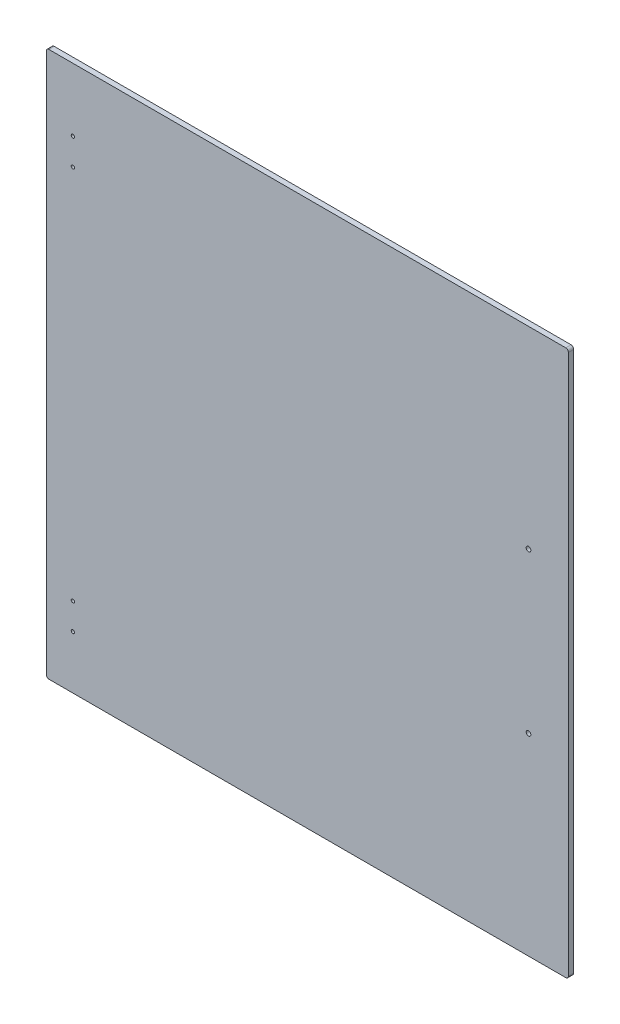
SolidWorks part; units mm, degrees
ref_plane "Ebene vorne" through (0, 0, 0) normal (0, 0, 1) x (1, 0, 0)
ref_plane "Ebene oben" through (0, 0, 0) normal (0, 1, 0) x (1, 0, 0)
ref_plane "Ebene rechts" through (0, 0, 0) normal (1, 0, 0) x (0, 0, -1)
sketch "Skizze1" plane through (0, 0, 0) normal (0, 0, 1) x (1, 0, 0)
  line L1 (-196.25, -205) -> (196.25, -205)
  line L2 (-196.25, -205) -> (-196.25, 205)
  line L3 (-196.25, 205) -> (196.25, 205)
  line L4 (196.25, -205) -> (196.25, 205)
  line L5 (-196.25, -205) -> (196.25, 205) construction
  line L6 (-196.25, 205) -> (196.25, -205) construction
  point P0 (0, 0)
  dimension "D1" = 410
  dimension "D2" = 392.5
extrude "Aufsatz-Linear austragen1" add sketch "Skizze1" along normal blind 4
fillet "Verrundung1" radius 2 4 edges at (-196.25, -205, 2) (196.25, -205, 2) (-196.25, 205, 2) (196.25, 205, 2)
hole_wizard "M3 Gewindebohrung1" positions "Skizze2" profile "Skizze3" tap size "M3" standard "DIN"
sketch "Skizze2" plane through (0, 0, 4) normal (0, 0, 1) x (1, 0, 0)
  line L0 (-196.25, 203) -> (-196.25, -203) construction
  line L1 (194.25, 205) -> (-194.25, 205) construction
  line L2 (-194.25, -205) -> (194.25, -205) construction
  point P0 (-176.25, 157.5)
  point P2 (-176.25, 137.5)
  point P4 (-176.25, -145)
  point P6 (-176.25, -165)
  dimension "D1" = 20
  dimension "D2" = 20
  dimension "D3" = 47.5
  dimension "D4" = 40
  dimension "D5" = 20
sketch "Skizze3" plane through (-176.25, 157.5, 4) normal (1, 0, 0) x (0, -1, 0)
  line L0 (0, 0) -> (0, 4)
  line L1 (0, 4) -> (1.25, 4)
  line L2 (1.25, 4) -> (1.25, 0)
  line L5 (1.25, 0) -> (0, 0)
  line L11 (0, -6.35) -> (0, 107.95) construction
  dimension "Bohrerdurchmesser" = 2.5
  dimension "Bohrungstiefe" = 4
hole_wizard "Ø3.5 (3.5) Durchmesser Bohrung1" positions "Skizze4" profile "Skizze5" hole size "Ø3.5" standard "DIN"
sketch "Skizze4" plane through (0, 0, 4) normal (0, 0, 1) x (1, 0, 0)
  line L0 (196.25, -203) -> (196.25, 203) construction
  point P0 (166.25, 60)
  point P2 (166.25, -60)
  dimension "D1" = 30
  dimension "D2" = 60
  dimension "D3" = 60
sketch "Skizze5" plane through (166.25, 60, 4) normal (1, 0, 0) x (0, -1, 0)
  line L0 (0, 0) -> (0, 4)
  line L1 (0, 4) -> (1.75, 4)
  line L2 (1.75, 4) -> (1.75, 0)
  line L5 (1.75, 0) -> (0, 0)
  line L11 (0, -6.35) -> (0, 107.95) construction
  dimension "Bohrerdurchmesser" = 3.5
  dimension "Bohrungstiefe" = 4
